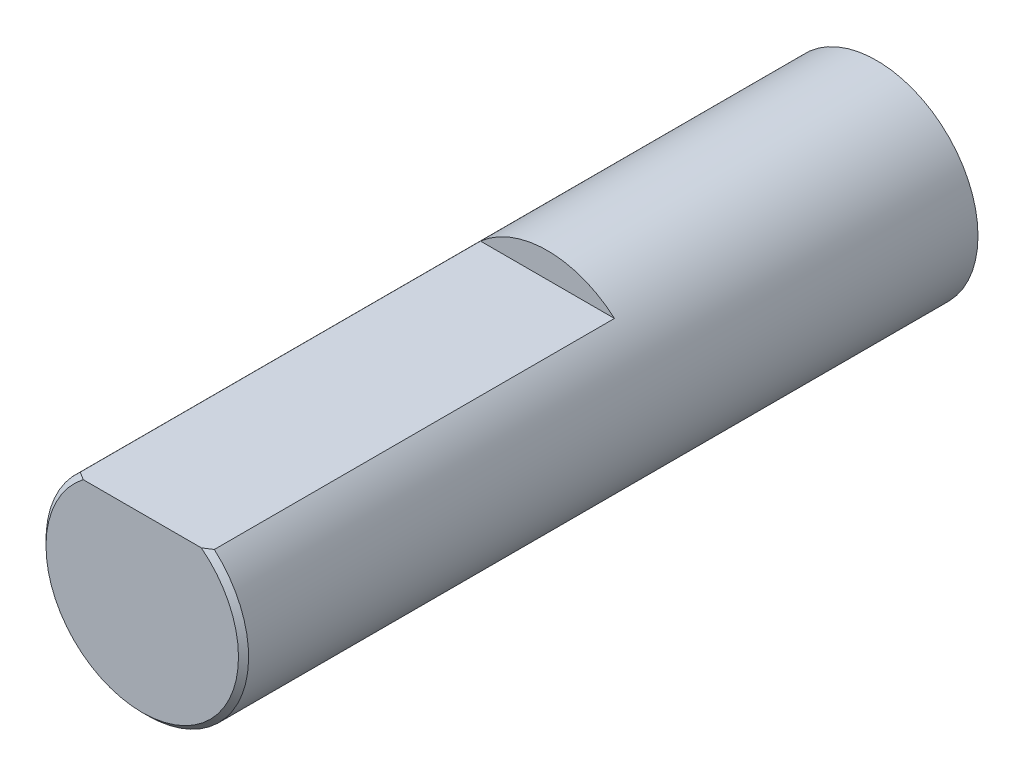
SolidWorks part; units mm, degrees
ref_plane "Front Plane" through (0, 0, 0) normal (0, 0, 1) x (1, 0, 0)
ref_plane "Top Plane" through (0, 0, 0) normal (0, 1, 0) x (1, 0, 0)
ref_plane "Right Plane" through (0, 0, 0) normal (1, 0, 0) x (0, 0, -1)
sketch "Sketch1" plane through (0, 0, 0) normal (0, 0, 1) x (1, 0, 0)
  circle A0 centre (0, 0) radius 2
  dimension "D1" = 4
extrude "Boss-Extrude1" add sketch "Sketch1" along normal blind 14.5
sketch "Sketch2" plane through (0, 0, 14.5) normal (0, 0, 1) x (1, 0, 0)
  line L0 (-1.3229, 1.5) -> (1.3229, 1.5)
  circle A0 centre (0, 0) radius 2 construction
  arc A1 (1.3229, 1.5) -> (-1.3229, 1.5) centre (0, 0) ccw
  dimension "D1" = 1.5
extrude "Cut-Extrude1" cut sketch "Sketch2" against normal blind 8
chamfer "Chamfer1" distance 0.1 angle 45 1 edges at (0, -2, 14.5)
